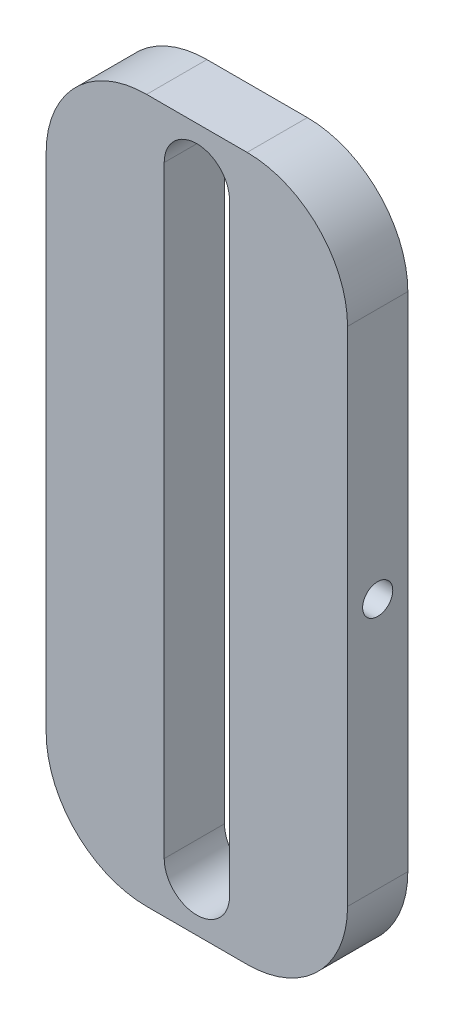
SolidWorks part; units mm, degrees
ref_plane "Front Plane" through (0, 0, 0) normal (0, 0, 1) x (1, 0, 0)
ref_plane "Top Plane" through (0, 0, 0) normal (0, 1, 0) x (1, 0, 0)
ref_plane "Right Plane" through (0, 0, 0) normal (1, 0, 0) x (0, 0, -1)
sketch "Sketch1" plane through (0, 0, 0) normal (0, 0, 1) x (1, 0, 0)
  line L0 (15, 70) -> (15, 0) construction
  line L1 (0, 0) -> (30, 0)
  line L2 (0, 0) -> (0, 70)
  line L3 (0, 70) -> (30, 70)
  line L4 (30, 0) -> (30, 70)
  line L5 (30, 35) -> (0, 35) construction
  line L6 (18.25, 5) -> (18.25, 65)
  line L7 (11.75, 5) -> (11.75, 65)
  arc A0 (11.75, 5) -> (18.25, 5) centre (15, 5) ccw
  arc A1 (11.75, 65) -> (18.25, 65) centre (15, 65) cw
  point P15 (11.75, 35)
  point P17 (18.25, 35)
  dimension "D1" = 6.5
  dimension "D4" = 30
  dimension "D2" = 70
  dimension "D3" = 30
extrude "Extrude1" add sketch "Sketch1" along normal blind 6
sketch "Sketch2" plane through (30, 0, 0) normal (1, 0, 0) x (0, 0, -1)
  line L0 (0, 70) -> (-6, 0) construction
  circle A0 centre (-3, 35) radius 1.5
  dimension "D1" = 3
extrude "Extrude2" cut sketch "Sketch2" against normal blind 10
ref_plane "Plane1" through (15, 0, 0) normal (1, 0, 0) x (0, 0, -1)
mirror "Mirror1" about plane through (15, 0, 0) normal (1, 0, 0) of "Extrude2"
fillet "Fillet1" radius 10 4 edges at (0, 0, 3) (30, 0, 3) (30, 70, 3) (0, 70, 3)
